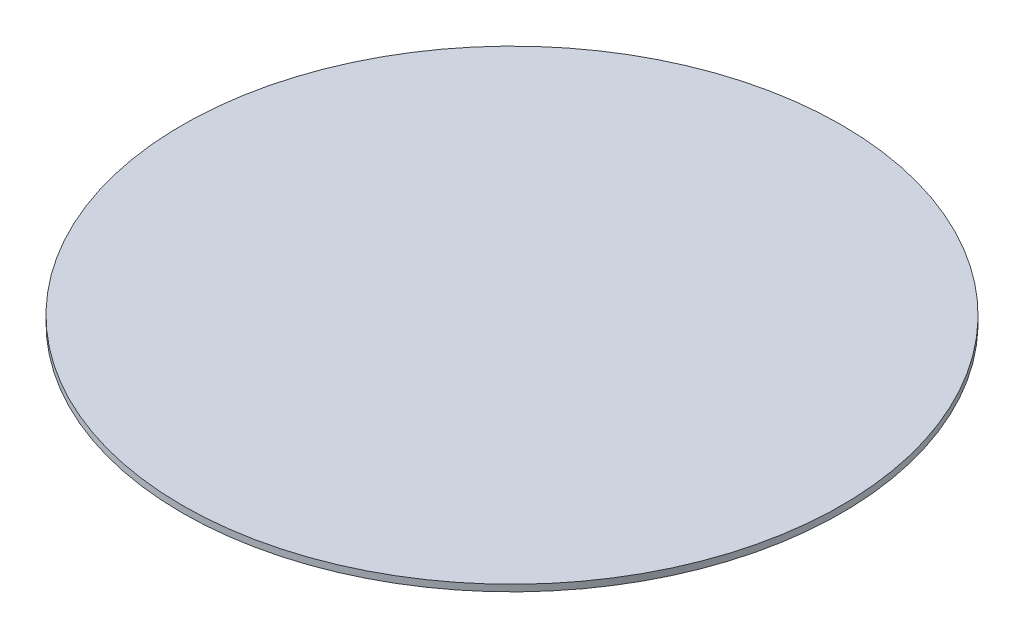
SolidWorks part; units mm, degrees
ref_plane "Front Plane" through (0, 0, 0) normal (0, 0, 1) x (1, 0, 0)
ref_plane "Top Plane" through (0, 0, 0) normal (0, 1, 0) x (1, 0, 0)
ref_plane "Right Plane" through (0, 0, 0) normal (1, 0, 0) x (0, 0, -1)
sketch "Sketch1" plane through (0, 0, 0) normal (0, 1, 0) x (1, 0, 0)
  line L1 (0, 0) -> (100, 0)
  line L2 (0, 0) -> (0, 100)
  line L3 (0, 100) -> (100, 100)
  line L4 (100, 0) -> (100, 100)
  dimension "D1" = 100
  dimension "D2" = 100
extrude "Extrude1" add sketch "Sketch1" along normal blind 1
sketch "Sketch2" plane through (0, 1, 0) normal (0, 1, 0) x (1, 0, 0)
  line L0 (0, 0) -> (100, 100)
  line L1 (0, 100) -> (100, 0)
  circle A0 centre (50, 50) radius 10
  circle A1 centre (50, 50) radius 20
  circle A2 centre (50, 50) radius 30
  circle A3 centre (50, 50) radius 40
  circle A4 centre (50, 50) radius 50
  dimension "D1" = 100
  dimension "D2" = 80
  dimension "D3" = 60
  dimension "D4" = 40
  dimension "D5" = 20
sketch "Sketch4" plane through (0, 1, 0) normal (0, 1, 0) x (1, 0, 0)
  line L0 (0, 100) -> (100, 100)
  line L1 (100, 100) -> (100, 0)
  line L2 (100, 0) -> (0, 0)
  line L3 (0, 0) -> (0, 100)
  circle A0 centre (50, 50) radius 50
  dimension "D1" = 100
extrude "Extrude3" cut sketch "Sketch4" against normal through all contours A0 L0 M1 | A0 L3 M2 | A0 L2 M3 | A0 L1 M4
